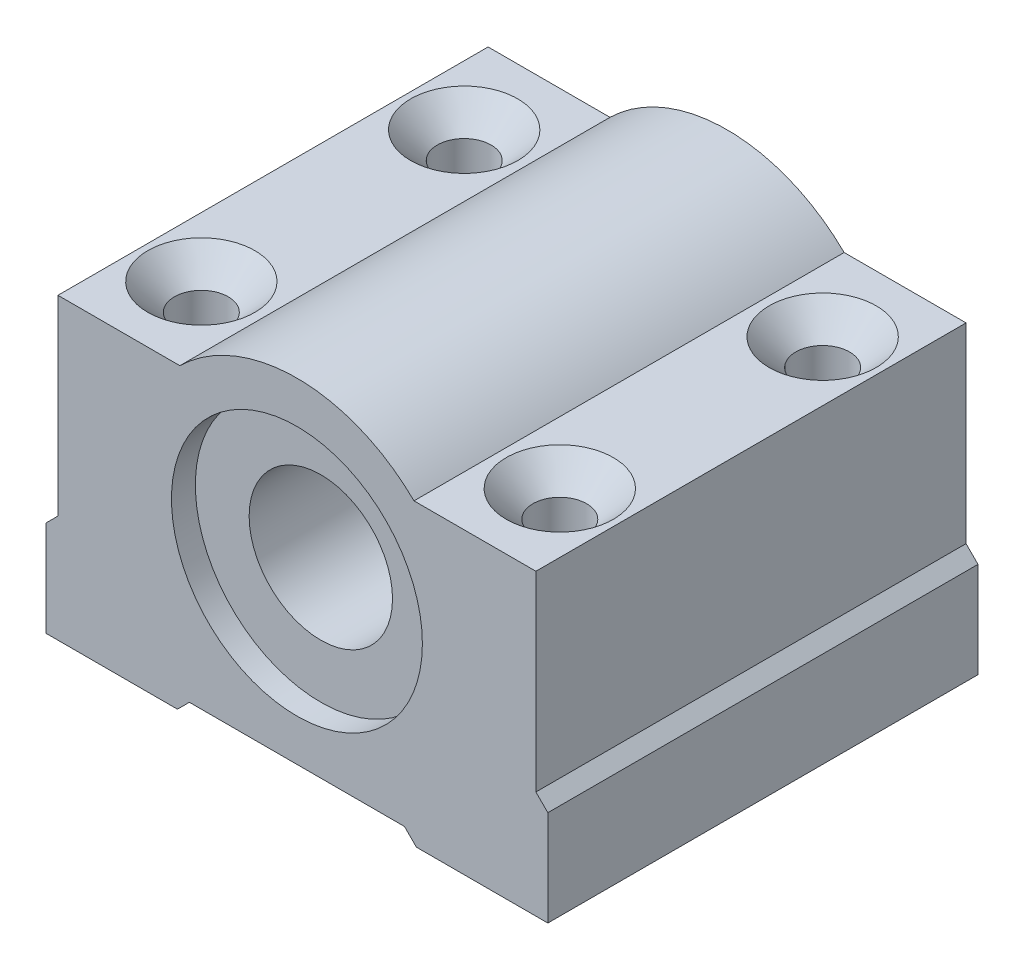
SolidWorks part; units mm, degrees
ref_plane "Front Plane" through (0, 0, 0) normal (0, 0, 1) x (1, 0, 0)
ref_plane "Top Plane" through (0, 0, 0) normal (0, 1, 0) x (1, 0, 0)
ref_plane "Right Plane" through (0, 0, 0) normal (1, 0, 0) x (0, 0, -1)
sketch "Sketch1" plane through (0, 0, 0) normal (0, 0, 1) x (1, 0, 0)
  line L0 (0, 0) -> (0, 8)
  line L1 (0, 8) -> (1, 9)
  line L2 (1, 9) -> (1, 25)
  line L3 (1, 25) -> (11.202, 25)
  line L4 (41, 25) -> (41, 9)
  line L5 (41, 9) -> (42, 8)
  line L6 (42, 8) -> (42, 0)
  line L7 (42, 0) -> (31, 0)
  line L8 (31, 0) -> (30, 1)
  line L9 (30, 1) -> (12, 1)
  line L10 (12, 1) -> (11, 0)
  line L11 (11, 0) -> (0, 0)
  line L12 (30.798, 25) -> (41, 25)
  arc A0 (30.798, 25) -> (11.202, 25) centre (21, 15) ccw
  circle A1 centre (21, 15) radius 6
  dimension "D11" = 14
  dimension "D12" = 12
  dimension "D1" = 8
  dimension "D2" = 25
  dimension "D3" = 1
  dimension "D4" = 40
  dimension "D5" = 135
  dimension "D6" = 11
  dimension "D7" = 1
  dimension "D8" = 45
  dimension "D9" = 15
  dimension "D10" = 20
extrude "Boss-Extrude1" add sketch "Sketch1" along normal mid plane 36
sketch "Sketch2" plane through (0, 0, 18) normal (0, 0, 1) x (1, 0, 0)
  circle A0 centre (21, 15) radius 10.5
  dimension "D1" = 21
extrude "Cut-Extrude1" cut sketch "Sketch2" against normal blind 2
mirror "Mirror1" about plane through (0, 0, 0) normal (0, 0, 1) of "Cut-Extrude1"
hole_wizard "CSK for M4 SFHCS1" positions "Sketch5" profile "Sketch6" countersink size "M4" standard "ANSI Metric"
sketch "Sketch5" plane through (0, 25, 0) normal (0, 1, 0) x (1, 0, 0)
  line L0 (41, -18) -> (41, 18) construction
  line L1 (41, -18) -> (30.798, -18) construction
  point P0 (36, -11)
  dimension "D1" = 5
  dimension "D2" = 7
sketch "Sketch6" plane through (36, 25, 11) normal (1, 0, 0) x (0, 0, 1)
  line L0 (0, 0) -> (0, 25)
  line L1 (0, 25) -> (2.25, 25)
  line L2 (2.25, 25) -> (2.25, 2.23)
  line L3 (2.25, 2.23) -> (4.48, 0)
  line L5 (4.48, 0) -> (0, 0)
  line L6 (-2.25, 2.23) -> (-4.48, 0) construction
  line L11 (0, -6.35) -> (0, 107.95) construction
  dimension "Thru Hole Dia." = 4.5
  dimension "Thru Hole Depth" = 25
  dimension "Near C'Sink Dia." = 8.96
  dimension "Near C'Sink Angle" = 90
pattern_linear "LPattern1" count 2 spacing 22 along (0, 0, -1) count 2 spacing 30 along (-1, 0, 0) of "CSK for M4 SFHCS1"
